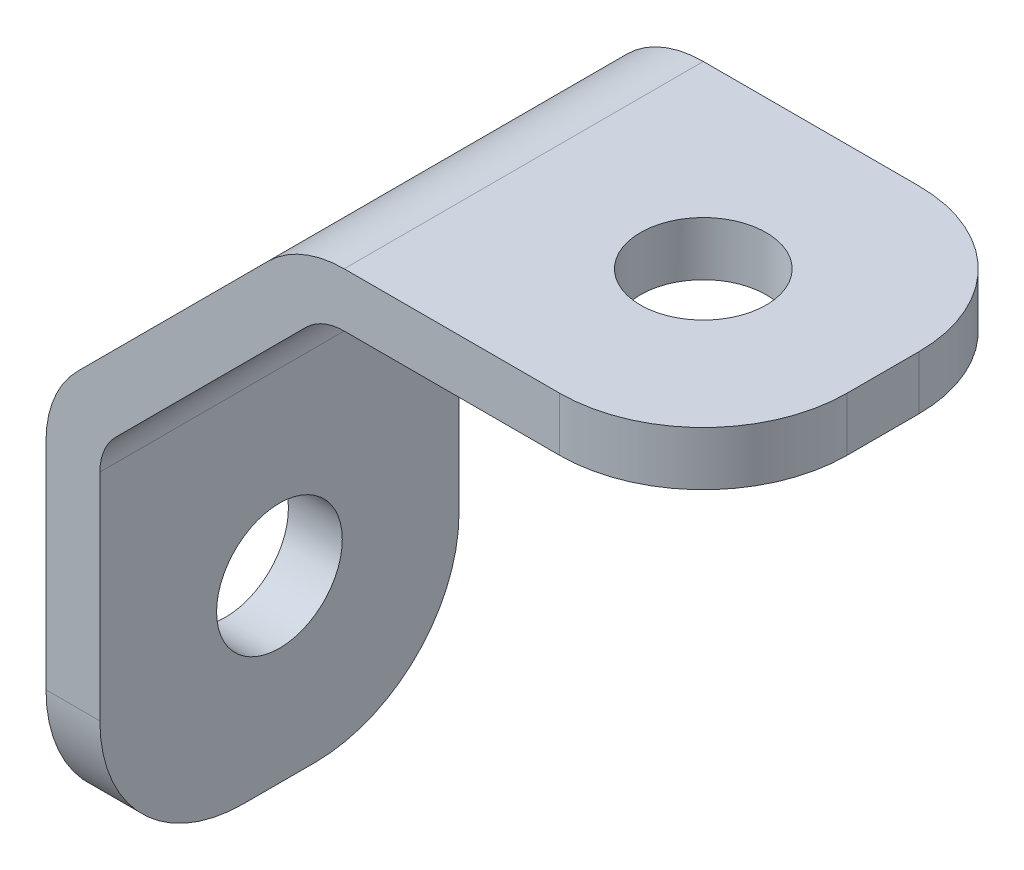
SolidWorks part; units mm, degrees
ref_plane "Plan1" through (0, 0, 0) normal (0, 0, 1) x (1, 0, 0)
ref_plane "Plan2" through (0, 0, 0) normal (0, 1, 0) x (1, 0, 0)
ref_plane "Plan3" through (0, 0, 0) normal (1, 0, 0) x (0, 0, -1)
sketch "Esquisse1" plane through (0, 0, 0) normal (0, 0, 1) x (1, 0, 0)
  line L0 (10.864, 24.8492) -> (0.2574, 14.2426)
  line L1 (-1.5, 10) -> (-1.5, -10)
  line L2 (15.1066, 26.6066) -> (35.1066, 26.6066)
  line L3 (35.1066, 26.6066) -> (35.1066, 23.6066)
  line L4 (35.1066, 23.6066) -> (15.1066, 23.6066)
  line L5 (12.9853, 22.7279) -> (2.3787, 12.1213)
  line L6 (1.5, 10) -> (1.5, -10)
  line L7 (1.5, -10) -> (-1.5, -10)
  arc A0 (1.5, 10) -> (2.3787, 12.1213) centre (4.5, 10) cw
  arc A1 (12.9853, 22.7279) -> (15.1066, 23.6066) centre (15.1066, 20.6066) cw
  arc A2 (0.2574, 14.2426) -> (-1.5, 10) centre (4.5, 10) ccw
  arc A3 (15.1066, 26.6066) -> (10.864, 24.8492) centre (15.1066, 20.6066) ccw
  dimension "D4" = 3
  dimension "D5" = 6
  dimension "D1" = 3
  dimension "D2" = 3
  dimension "D3" = 3
  dimension "D6" = 15
  dimension "D7" = 20
  dimension "D8" = 20
  dimension "D9" = 10
  dimension "D10" = 1.5
  dimension "D11" = 135
  dimension "D12" = 135
extrude "Base-Extrusion" add sketch "Esquisse1" along normal mid plane 20
sketch "Esquisse2" plane through (-1.5, 0, 0) normal (-1, 0, 0) x (0, 0, 1)
  line L1 (10, -10) -> (-10, -10) construction
  line L2 (10, 10) -> (10, -10) construction
  line L3 (-10, 10) -> (-10, -10) construction
  circle A0 centre (0, 0) radius 3.5
  arc A1 (-10, -2) -> (-2, -10) centre (-2, -2) ccw
  arc A2 (2, -10) -> (10, -2) centre (2, -2) ccw
  spline_without_curve S0
  spline_without_curve S1
  dimension "D1" = 8
  dimension "D4" = 7
  dimension "D2" = 10
  dimension "D3" = 10
extrude "Enlèv. mat.-Extru.1" cut sketch "Esquisse2" against normal through all
sketch "Esquisse3" plane through (0, 26.6066, 0) normal (0, 1, 0) x (-1, 0, 0)
  line L1 (-15.1066, 10) -> (-35.1066, 10) construction
  line L2 (-35.1066, 10) -> (-35.1066, -10) construction
  line L3 (-15.1066, -10) -> (-35.1066, -10) construction
  circle A0 centre (-25.1066, 0) radius 3.5
  arc A1 (-27.1066, 10) -> (-35.1066, 2) centre (-27.1066, 2) ccw
  arc A2 (-35.1066, -2) -> (-27.1066, -10) centre (-27.1066, -2) ccw
  spline_without_curve S0
  spline_without_curve S1
  dimension "D1" = 8
  dimension "D4" = 7
  dimension "D5" = 8
  dimension "D2" = 10
  dimension "D3" = 10
extrude "Enlèv. mat.-Extru.2" cut sketch "Esquisse3" against normal through all
